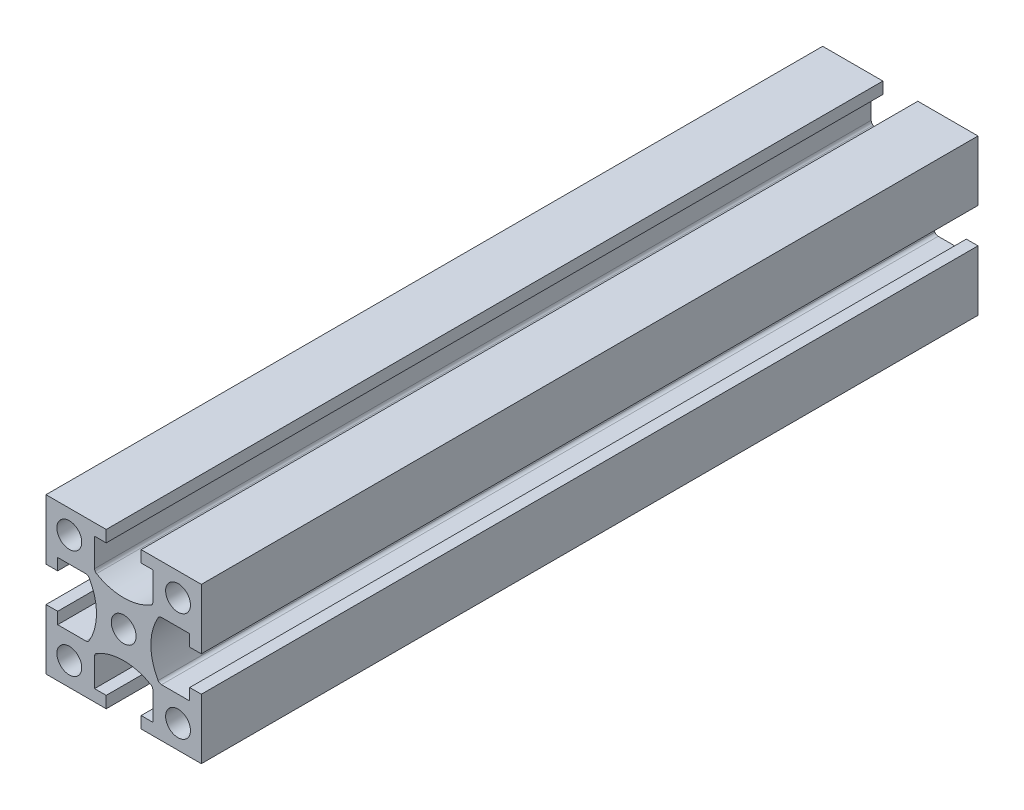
SolidWorks part; units mm, degrees
ref_plane "前基準面" through (0, 0, 0) normal (0, 0, 1) x (1, 0, 0)
ref_plane "上基準面" through (0, 0, 0) normal (0, 1, 0) x (1, 0, 0)
ref_plane "右基準面" through (0, 0, 0) normal (1, 0, 0) x (0, 0, -1)
sketch "草圖1" plane through (0, 0, 0) normal (0, 0, 1) x (1, 0, 0)
  line L0 (0, 53.2301) -> (0, -51.0629) construction
  line L1 (-59.8379, 0) -> (53.1236, 0) construction
  line L2 (-10, 10) -> (-2.2486, 10)
  line L3 (10, 10) -> (10, 2.25)
  line L4 (10, 2.25) -> (8.5, 2.25)
  line L5 (8.5, 2.25) -> (8.5, 3.75)
  line L6 (8.5, 3.75) -> (4.8708, 3.75)
  line L7 (8.5, -3.75) -> (4.8708, -3.75)
  line L8 (8.5, -2.25) -> (8.5, -3.75)
  line L9 (10, -2.25) -> (8.5, -2.25)
  line L10 (10, -10) -> (10, -2.25)
  line L11 (-10, -10) -> (-2.2486, -10)
  line L12 (-10, -10) -> (-10, -2.25)
  line L13 (-10, -2.25) -> (-8.5, -2.25)
  line L14 (-8.5, -2.25) -> (-8.5, -3.75)
  line L15 (-8.5, -3.75) -> (-4.8708, -3.75)
  line L16 (-8.5, 3.75) -> (-4.8708, 3.75)
  line L17 (-8.5, 2.25) -> (-8.5, 3.75)
  line L18 (-10, 2.25) -> (-8.5, 2.25)
  line L19 (-10, 10) -> (-10, 2.25)
  line L20 (2.2514, -10) -> (2.2514, -8.5)
  line L21 (-2.2486, -10) -> (-2.2486, -8.5)
  line L22 (-2.2486, -8.5) -> (-3.7486, -8.5)
  line L23 (-3.7486, -8.5) -> (-3.7486, -4.8708)
  line L24 (3.7514, -8.5) -> (3.7514, -4.8708)
  line L25 (2.2514, -8.5) -> (3.7514, -8.5)
  line L26 (0, 0) -> (7, 7) construction
  line L28 (2.2514, 8.5) -> (3.7514, 8.5)
  line L29 (3.7514, 8.5) -> (3.7514, 4.8708)
  line L30 (-3.7486, 8.5) -> (-3.7486, 4.8708)
  line L31 (-2.2486, 8.5) -> (-3.7486, 8.5)
  line L32 (-2.2486, 10) -> (-2.2486, 8.5)
  line L33 (2.2514, 10) -> (2.2514, 8.5)
  line L34 (2.2514, -10) -> (10, -10)
  line L35 (2.2514, 10) -> (10, 10)
  arc A0 (4.4378, 3.5) -> (4.4378, -3.5) centre (10.5, 0) ccw
  arc A1 (4.8708, 3.75) -> (4.4378, 3.5) centre (4.8708, 3.25) ccw
  arc A2 (4.8708, -3.75) -> (4.4378, -3.5) centre (4.8708, -3.25) cw
  arc A3 (-4.8708, -3.75) -> (-4.4378, -3.5) centre (-4.8708, -3.25) ccw
  arc A4 (-4.8708, 3.75) -> (-4.4378, 3.5) centre (-4.8708, 3.25) cw
  arc A5 (-4.4378, 3.5) -> (-4.4378, -3.5) centre (-10.5, 0) cw
  circle A6 centre (7, 7) radius 1.6
  circle A7 centre (0.0014, 0) radius 1.6
  arc A8 (-3.7486, -4.8708) -> (-3.4986, -4.4378) centre (-3.2486, -4.8708) cw
  arc A9 (3.5014, -4.4378) -> (-3.4986, -4.4378) centre (0.0014, -10.5) ccw
  arc A10 (3.7514, -4.8708) -> (3.5014, -4.4378) centre (3.2514, -4.8708) ccw
  arc A11 (3.7514, 4.8708) -> (3.5014, 4.4378) centre (3.2514, 4.8708) cw
  arc A12 (-3.7486, 4.8708) -> (-3.4986, 4.4378) centre (-3.2486, 4.8708) ccw
  arc A13 (3.5014, 4.4378) -> (-3.4986, 4.4378) centre (0.0014, 10.5) cw
  circle A14 centre (0, 0) radius 1.6
  circle A15 centre (7, -7) radius 1.6
  circle A16 centre (-7, -7) radius 1.6
  circle A17 centre (-7, 7) radius 1.6
  point P30 (0, -10)
  point P37 (0, 10)
  point P57 (3.5, 0)
  dimension "D1" = 0.5
  dimension "D3" = 7
  dimension "D2" = 0.5
  dimension "D9" = 14
  dimension "D11" = 14
  dimension "D12" = 3.2
  dimension "D4" = 20
  dimension "D5" = 20
  dimension "D6" = 7.5
  dimension "D7" = 4.5
  dimension "D8" = 1.5
  dimension "D13" = 4
  dimension "D10" = 2
extrude "填料-伸長1" add sketch "草圖1" along normal mid plane 100
